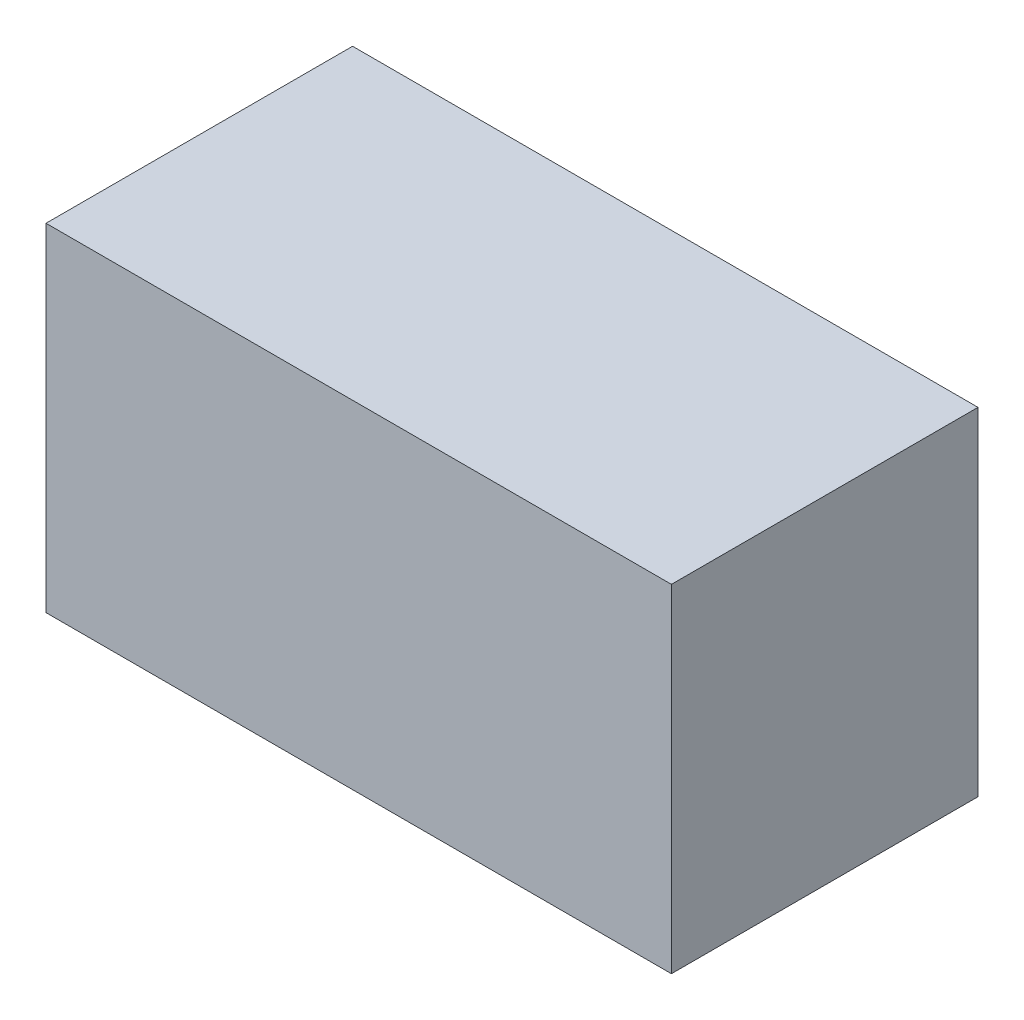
SolidWorks part; units mm, degrees
ref_plane "前视基准面" through (0, 0, 0) normal (0, 0, 1) x (1, 0, 0)
ref_plane "上视基准面" through (0, 0, 0) normal (0, 1, 0) x (1, 0, 0)
ref_plane "右视基准面" through (0, 0, 0) normal (1, 0, 0) x (0, 0, -1)
other "Configuration Table"
sketch "草图1" plane through (0, 0, 0) normal (0, 1, 0) x (1, 0, 0)
  line L1 (0, 0) -> (10.2, 0)
  line L2 (0, 0) -> (0, 5)
  line L3 (0, 5) -> (10.2, 5)
  line L4 (10.2, 0) -> (10.2, 5)
  point P5 (0, 0)
  point P6 (0, 0)
  point P7 (0, 0)
  point P8 (0, 0)
  point P9 (0, 0)
  point P10 (0, 0)
  point P11 (0, 0)
  point P12 (0, 0)
  point P13 (0, 0)
extrude "凸台-拉伸1" add sketch "草图1" along normal blind 5.5
sketch "草图3" plane through (0, 0, 0) normal (0, 1, 0) x (1, 0, 0)
  circle A0 centre (8.2, 2.5) radius 1.5
  point P2 (0, 0)
  point P3 (0, 0)
  point P4 (0, 0)
  point P5 (0, 0)
sketch "草图6" plane through (0, 0, 0) normal (0, 1, 0) x (1, 0, 0)
  circle A0 centre (5.1, 2.5) radius 1.5
  point P2 (0, 0)
  point P3 (0, 0)
sketch "草图7" plane through (0, 0, 0) normal (0, 1, 0) x (1, 0, 0)
  circle A0 centre (2, 2.5) radius 1.5
  point P2 (0, 0)
  point P3 (0, 0)
  point P4 (0, 0)
extrude "切除-拉伸6" cut sketch "草图7" along normal blind 2
extrude "切除-拉伸7" cut sketch "草图6" along normal blind 3.2
extrude "切除-拉伸9" cut sketch "草图3" along normal blind 4.8
